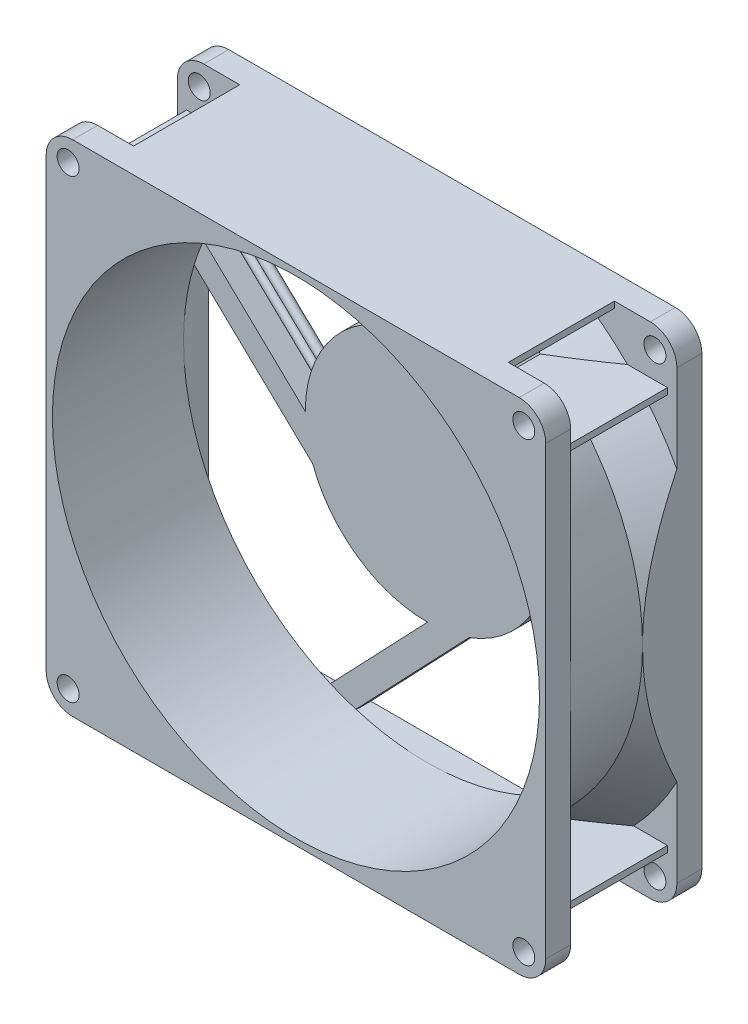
SolidWorks part; units mm, degrees
ref_plane "Plan de face" through (0, 0, 0) normal (0, 0, 1) x (1, 0, 0)
ref_plane "Plan de dessus" through (0, 0, 0) normal (0, 1, 0) x (1, 0, 0)
ref_plane "Plan de droite" through (0, 0, 0) normal (1, 0, 0) x (0, 0, -1)
imported_body "Cut-Extrude2"
sketch "草图1" plane through (0, 0, 18.0428) normal (0, 0, 1) x (1, 0, 0)
  circle A0 centre (0, 0) radius 43.5124
extrude "切除-拉伸1" cut sketch "草图1" against normal up to surface (22.1812 mm away)
sketch "草图2" plane through (0, 0, -8.6885) normal (0, 0, -1) x (-1, 0, 0)
  circle A0 centre (0, 0) radius 19.8812
extrude "切除-拉伸2" cut sketch "草图2" against normal blind 0.2
sketch "Sketch2" plane through (0, 0, -8.6885) normal (0, 0, -1) x (-1, 0, 0)
  line L0 (-44.0712, 44.1055) -> (44.0969, -44.0625)
  arc A0 (-40.6528, 45.5215) -> (-45.4872, 40.6871) centre (-40.6528, 40.6871) ccw construction
  arc A1 (40.6785, -45.4785) -> (45.5128, -40.6441) centre (40.6785, -40.6441) ccw construction
